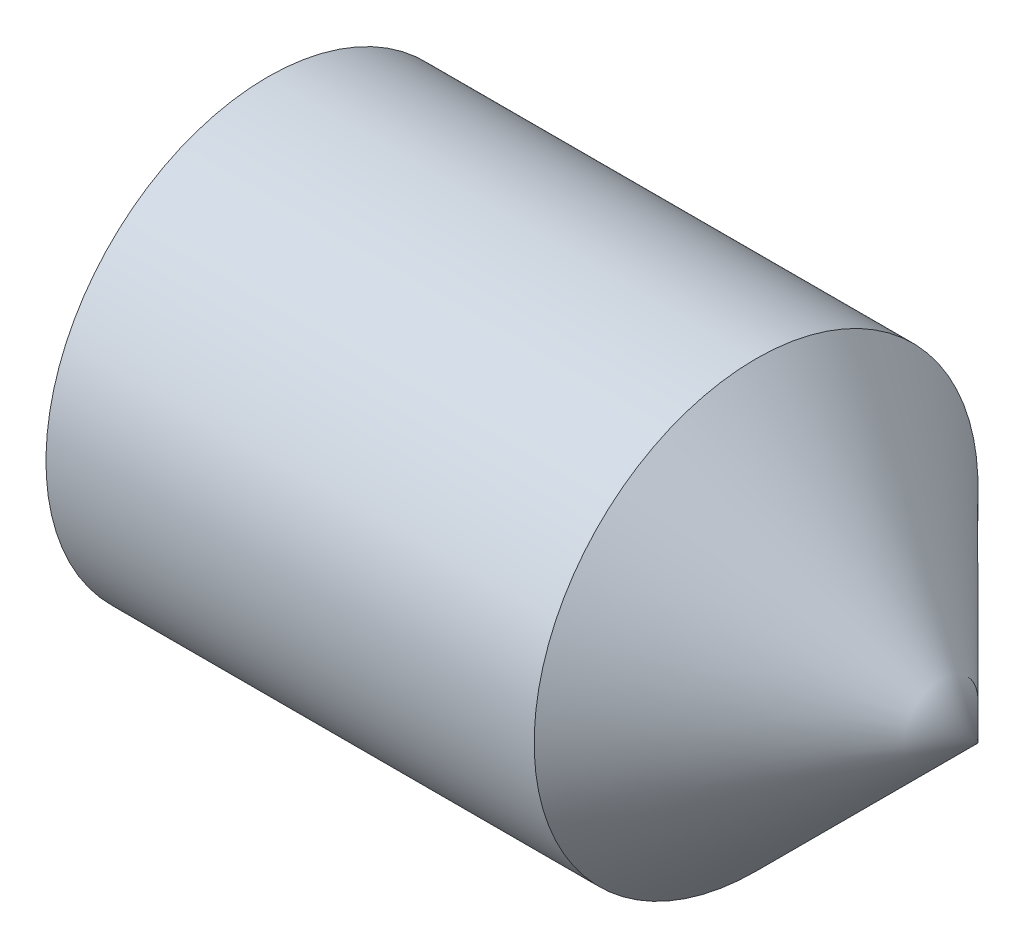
SolidWorks part; units mm, degrees
ref_plane "Front" through (0, 0, 0) normal (0, 0, 1) x (1, 0, 0)
ref_plane "Top" through (0, 0, 0) normal (0, 1, 0) x (1, 0, 0)
ref_plane "Right" through (0, 0, 0) normal (1, 0, 0) x (0, 0, -1)
sketch "Sketch1" plane through (0, 0, 0) normal (0, 0, 1) x (1, 0, 0)
  line L0 (0, 3.9687) -> (8.7313, 3.9687)
  line L1 (8.7313, 3.9687) -> (12.7, 0)
  line L2 (12.7, 0) -> (-72.6807, 0) construction
  line L3 (0, 3.9687) -> (0, 0)
  line L4 (12.7, 0) -> (0, 0)
  dimension "D1" = 45
  dimension "D2" = 7.9375
  dimension "D3" = 12.7
revolve "Revolve3" add sketch "Sketch1" angle 360 about L2
sketch "Sketch2" plane through (0, 0, 0) normal (-1, 0, 0) x (0, 0, 1)
  line L1 (2.2117, -0.5846) -> (1.6122, 1.6231)
  line L2 (1.6122, 1.6231) -> (-0.5996, 2.2077)
  line L3 (-0.5996, 2.2077) -> (-2.2117, 0.5846)
  line L4 (-2.2117, 0.5846) -> (-1.6122, -1.6231)
  line L5 (-1.6122, -1.6231) -> (0.5996, -2.2077)
  line L6 (0.5996, -2.2077) -> (2.2117, -0.5846)
  circle A0 centre (0, 0) radius 1.9812 construction
  dimension "D1" = 3.9624
extrude "Cut-Extrude1" cut sketch "Sketch2" against normal blind 3.9624
